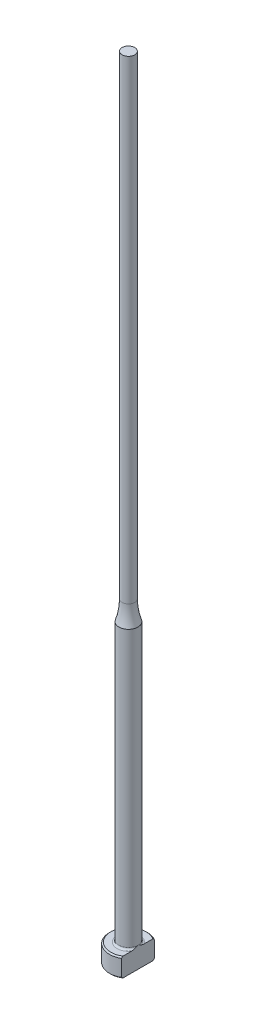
SolidWorks part; units mm, degrees
ref_plane "Front Plane" through (0, 0, 0) normal (0, 0, 1) x (1, 0, 0)
ref_plane "Top Plane" through (0, 0, 0) normal (0, 1, 0) x (1, 0, 0)
ref_plane "Right Plane" through (0, 0, 0) normal (1, 0, 0) x (0, 0, -1)
sketch "Sketch1" plane through (0, 0, 0) normal (0, 0, 1) x (1, 0, 0)
  line L0 (0, 259.9588) -> (0, -15.1925) construction
  line L1 (0, 0) -> (-3, 0)
  line L2 (-3, 0) -> (-3, 3)
  line L3 (-3, 3) -> (-1.5, 3)
  line L4 (-1, 50) -> (-1, 125)
  line L5 (-1, 125) -> (0, 125)
  line L6 (0, 125) -> (0, 0)
  line L7 (-1.5, 3) -> (-1.5, 46.8775)
  arc A0 (-1.5, 46.8775) -> (-1, 50) centre (-11, 50) ccw
  point P13 (-1.5, 0)
  dimension "D1" = 10
  dimension "L" = 125
  dimension "H" = 6
  dimension "T" = 3
  dimension "D" = 2
  dimension "B" = 3
  dimension "S" = 50
revolve "Revolve1" add sketch "Sketch1" angle 360 about L0
chamfer "Chamfer1" distance 0.2 angle 45 2 edges at (0, 3, 3) (0, 0, 3)
fillet "Fillet1" radius 0.3 1 edges at (0, 3, 1.5)
sketch "Sketch2" plane through (0, 0, 0) normal (0, 1, 0) x (1, 0, 0)
  line L0 (1.5, 2.5981) -> (1.5, -2.5981)
  circle A0 centre (0, 0) radius 3 construction
  arc A1 (1.5, -2.5981) -> (1.5, 2.5981) centre (0, 0) ccw
  circle A2 centre (0, 0) radius 1.5 construction
extrude "KEY" cut sketch "Sketch2" along normal through all
